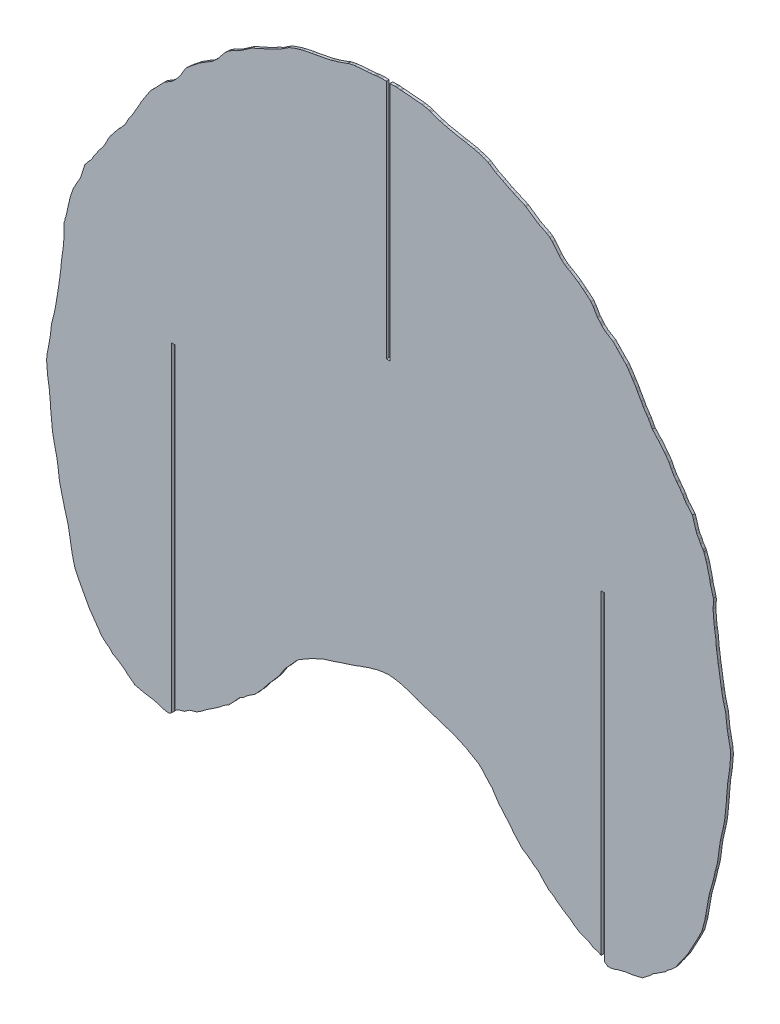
SolidWorks part; units mm, degrees
ref_plane "Спереди" through (0, 0, 0) normal (0, 0, 1) x (1, 0, 0)
ref_plane "Сверху" through (0, 0, 0) normal (0, 1, 0) x (1, 0, 0)
ref_plane "Справа" through (0, 0, 0) normal (1, 0, 0) x (0, 0, -1)
sketch "Model" plane through (0, 0, 0) normal (0, 0, 1) x (1, 0, 0)
  line L0 (-4968.8727, 2054.1459) -> (-4972.0302, 2054.3033)
  line L1 (-4972.0302, 2054.3033) -> (-4973.663, 2054.203)
  line L2 (-4973.663, 2054.203) -> (-4975.2956, 2054.1029)
  line L3 (-4975.2956, 2054.1029) -> (-4975.8599, 2054.0262)
  line L4 (-4975.8599, 2054.0262) -> (-4976.4242, 2053.9498)
  line L5 (-4976.4242, 2053.9498) -> (-4976.672, 2053.8861)
  line L6 (-4976.672, 2053.8861) -> (-4976.9199, 2053.8226)
  line L7 (-4976.9199, 2053.8226) -> (-4978.1276, 2053.6493)
  line L8 (-4978.1276, 2053.6493) -> (-4980.5238, 2053.4764)
  line L9 (-4980.5238, 2053.4764) -> (-4982.9202, 2053.3033)
  line L10 (-4982.9202, 2053.3033) -> (-4991.4543, 2052.597)
  line L11 (-4991.4543, 2052.597) -> (-4992.0593, 2052.4813)
  line L12 (-4992.0593, 2052.4813) -> (-4994.2126, 2052.0589)
  line L13 (-4994.2126, 2052.0589) -> (-4996.3659, 2051.6368)
  line L14 (-4996.3659, 2051.6368) -> (-4996.9471, 2051.3494)
  line L15 (-4996.9471, 2051.3494) -> (-4997.5284, 2051.0623)
  line L16 (-4997.5284, 2051.0623) -> (-5004.2963, 2048.6869)
  line L17 (-5004.2963, 2048.6869) -> (-5005.7665, 2048.3661)
  line L18 (-5005.7665, 2048.3661) -> (-5007.3816, 2047.8578)
  line L19 (-5007.3816, 2047.8578) -> (-5008.9967, 2047.3497)
  line L20 (-5008.9967, 2047.3497) -> (-5020.1828, 2045.1541)
  line L21 (-5020.1828, 2045.1541) -> (-5022.5702, 2044.7743)
  line L22 (-5022.5702, 2044.7743) -> (-5028.8949, 2043.4935)
  line L23 (-5028.8949, 2043.4935) -> (-5030.5226, 2043.0555)
  line L24 (-5030.5226, 2043.0555) -> (-5032.1504, 2042.6173)
  line L25 (-5032.1504, 2042.6173) -> (-5033.9631, 2042.0238)
  line L26 (-5033.9631, 2042.0238) -> (-5035.7756, 2041.4305)
  line L27 (-5035.7756, 2041.4305) -> (-5038.7476, 2040.2767)
  line L28 (-5038.7476, 2040.2767) -> (-5038.9575, 2040.1732)
  line L29 (-5038.9575, 2040.1732) -> (-5039.1675, 2040.0694)
  line L30 (-5039.1675, 2040.0694) -> (-5040.488, 2039.2628)
  line L31 (-5040.488, 2039.2628) -> (-5044.7383, 2036.4613)
  line L32 (-5044.7383, 2036.4613) -> (-5048.6056, 2034.6222)
  line L33 (-5048.6056, 2034.6222) -> (-5055.1681, 2031.0882)
  line L34 (-5055.1681, 2031.0882) -> (-5056.3617, 2030.6375)
  line L35 (-5056.3617, 2030.6375) -> (-5057.5554, 2030.1871)
  line L36 (-5057.5554, 2030.1871) -> (-5065.5879, 2026.5345)
  line L37 (-5065.5879, 2026.5345) -> (-5066.0519, 2026.3006)
  line L38 (-5066.0519, 2026.3006) -> (-5066.6717, 2025.9105)
  line L39 (-5066.6717, 2025.9105) -> (-5074.5742, 2020.4788)
  line L40 (-5074.5742, 2020.4788) -> (-5076.5312, 2019.5111)
  line L41 (-5076.5312, 2019.5111) -> (-5076.5784, 2019.4286)
  line L42 (-5076.5784, 2019.4286) -> (-5076.6257, 2019.3463)
  line L43 (-5076.6257, 2019.3463) -> (-5079.9656, 2017.8443)
  line L44 (-5079.9656, 2017.8443) -> (-5081.328, 2017.0023)
  line L45 (-5081.328, 2017.0023) -> (-5082.6904, 2016.1605)
  line L46 (-5082.6904, 2016.1605) -> (-5084.7595, 2014.4015)
  line L47 (-5084.7595, 2014.4015) -> (-5085.3288, 2013.8426)
  line L48 (-5085.3288, 2013.8426) -> (-5085.8982, 2013.284)
  line L49 (-5085.8982, 2013.284) -> (-5090.5989, 2007.3709)
  line L50 (-5090.5989, 2007.3709) -> (-5091.5746, 2006.5726)
  line L51 (-5091.5746, 2006.5726) -> (-5094.2019, 2004.025)
  line L52 (-5094.2019, 2004.025) -> (-5096.6413, 2002.4683)
  line L53 (-5096.6413, 2002.4683) -> (-5096.8489, 2002.3673)
  line L54 (-5096.8489, 2002.3673) -> (-5097.089, 2002.2513)
  line L55 (-5097.089, 2002.2513) -> (-5097.329, 2002.1351)
  line L56 (-5097.329, 2002.1351) -> (-5097.5746, 2002.035)
  line L57 (-5097.5746, 2002.035) -> (-5104.2345, 1997.7999)
  line L58 (-5104.2345, 1997.7999) -> (-5107.4574, 1995.1798)
  line L59 (-5107.4574, 1995.1798) -> (-5109.2212, 1993.8536)
  line L60 (-5109.2212, 1993.8536) -> (-5113.1637, 1990.419)
  line L61 (-5113.1637, 1990.419) -> (-5114.8129, 1988.1842)
  line L62 (-5114.8129, 1988.1842) -> (-5117.3183, 1983.8524)
  line L63 (-5117.3183, 1983.8524) -> (-5117.5859, 1983.4989)
  line L64 (-5117.5859, 1983.4989) -> (-5117.7652, 1983.1859)
  line L65 (-5117.7652, 1983.1859) -> (-5117.9447, 1982.8726)
  line L66 (-5117.9447, 1982.8726) -> (-5120.415, 1979.971)
  line L67 (-5120.415, 1979.971) -> (-5121.2694, 1978.9647)
  line L68 (-5121.2694, 1978.9647) -> (-5123.8916, 1976.6449)
  line L69 (-5123.8916, 1976.6449) -> (-5125.7547, 1975.5257)
  line L70 (-5125.7547, 1975.5257) -> (-5129.2042, 1973.3988)
  line L71 (-5129.2042, 1973.3988) -> (-5132.4723, 1970.0335)
  line L72 (-5132.4723, 1970.0335) -> (-5135.9791, 1966.3057)
  line L73 (-5135.9791, 1966.3057) -> (-5138.942, 1963.4137)
  line L74 (-5138.942, 1963.4137) -> (-5140.5076, 1961.1207)
  line L75 (-5140.5076, 1961.1207) -> (-5142.9455, 1957.3731)
  line L76 (-5142.9455, 1957.3731) -> (-5145.9204, 1952.7769)
  line L77 (-5145.9204, 1952.7769) -> (-5146.8116, 1950.9649)
  line L78 (-5146.8116, 1950.9649) -> (-5149.9659, 1945.5455)
  line L79 (-5149.9659, 1945.5455) -> (-5151.5932, 1942.5379)
  line L80 (-5151.5932, 1942.5379) -> (-5151.853, 1942.1991)
  line L81 (-5151.853, 1942.1991) -> (-5152.1127, 1941.8599)
  line L82 (-5152.1127, 1941.8599) -> (-5152.943, 1940.5611)
  line L83 (-5152.943, 1940.5611) -> (-5154.7417, 1938.1046)
  line L84 (-5154.7417, 1938.1046) -> (-5157.0868, 1933.6693)
  line L85 (-5157.0868, 1933.6693) -> (-5157.4029, 1933.0824)
  line L86 (-5157.4029, 1933.0824) -> (-5157.7189, 1932.4952)
  line L87 (-5157.7189, 1932.4952) -> (-5158.1402, 1932.0579)
  line L88 (-5158.1402, 1932.0579) -> (-5158.5616, 1931.6209)
  line L89 (-5158.5616, 1931.6209) -> (-5160.8255, 1929.0128)
  line L90 (-5160.8255, 1929.0128) -> (-5162.7114, 1927.212)
  line L91 (-5162.7114, 1927.212) -> (-5165.4336, 1923.7225)
  line L92 (-5165.4336, 1923.7225) -> (-5167.7956, 1920.7745)
  line L93 (-5167.7956, 1920.7745) -> (-5169.6033, 1918.1136)
  line L94 (-5169.6033, 1918.1136) -> (-5171.8115, 1913.5604)
  line L95 (-5171.8115, 1913.5604) -> (-5173.3644, 1911.0863)
  line L96 (-5173.3644, 1911.0863) -> (-5175.1208, 1908.7992)
  line L97 (-5175.1208, 1908.7992) -> (-5175.2746, 1908.6097)
  line L98 (-5175.2746, 1908.6097) -> (-5175.4285, 1908.4205)
  line L99 (-5175.4285, 1908.4205) -> (-5175.6517, 1908.1434)
  line L100 (-5175.6517, 1908.1434) -> (-5175.875, 1907.8661)
  line L101 (-5175.875, 1907.8661) -> (-5176.6948, 1906.6829)
  line L102 (-5176.6948, 1906.6829) -> (-5179.9867, 1902.1703)
  line L103 (-5179.9867, 1902.1703) -> (-5180.2864, 1901.5267)
  line L104 (-5180.2864, 1901.5267) -> (-5180.5861, 1900.8834)
  line L105 (-5180.5861, 1900.8834) -> (-5182.0613, 1898.472)
  line L106 (-5182.0613, 1898.472) -> (-5182.8296, 1897.6698)
  line L107 (-5182.8296, 1897.6698) -> (-5183.598, 1896.8678)
  line L108 (-5183.598, 1896.8678) -> (-5186.4246, 1893.4452)
  line L109 (-5186.4246, 1893.4452) -> (-5187.6987, 1889.7684)
  line L110 (-5187.6987, 1889.7684) -> (-5189.3438, 1884.4974)
  line L111 (-5189.3438, 1884.4974) -> (-5190.1741, 1882.5924)
  line L112 (-5190.1741, 1882.5924) -> (-5191.0915, 1881.0025)
  line L113 (-5191.0915, 1881.0025) -> (-5192.267, 1879.0977)
  line L114 (-5192.267, 1879.0977) -> (-5194.0179, 1875.6866)
  line L115 (-5194.0179, 1875.6866) -> (-5194.181, 1875.4449)
  line L116 (-5194.181, 1875.4449) -> (-5194.3441, 1875.2032)
  line L117 (-5194.3441, 1875.2032) -> (-5195.0731, 1873.9786)
  line L118 (-5195.0731, 1873.9786) -> (-5195.4039, 1872.7362)
  line L119 (-5195.4039, 1872.7362) -> (-5196.543, 1869.6012)
  line L120 (-5196.543, 1869.6012) -> (-5197.0569, 1867.9911)
  line L121 (-5197.0569, 1867.9911) -> (-5198.8898, 1860.2767)
  line L122 (-5198.8898, 1860.2767) -> (-5199.5404, 1856.7767)
  line L123 (-5199.5404, 1856.7767) -> (-5200.4352, 1853.4947)
  line L124 (-5200.4352, 1853.4947) -> (-5200.908, 1852.0909)
  line L125 (-5200.908, 1852.0909) -> (-5200.8514, 1851.8387)
  line L126 (-5200.8514, 1851.8387) -> (-5200.7948, 1851.5865)
  line L127 (-5200.7948, 1851.5865) -> (-5201.6117, 1849.5777)
  line L128 (-5201.6117, 1849.5777) -> (-5201.7248, 1844.9102)
  line L129 (-5201.7248, 1844.9102) -> (-5201.533, 1841.5428)
  line L130 (-5201.533, 1841.5428) -> (-5202.1587, 1833.9964)
  line L131 (-5202.1587, 1833.9964) -> (-5202.4552, 1831.5438)
  line L132 (-5202.4552, 1831.5438) -> (-5202.5878, 1830.888)
  line L133 (-5202.5878, 1830.888) -> (-5203.4105, 1825.2974)
  line L134 (-5203.4105, 1825.2974) -> (-5203.9104, 1819.5023)
  line L135 (-5203.9104, 1819.5023) -> (-5204.0532, 1818.431)
  line L136 (-5204.0532, 1818.431) -> (-5204.1957, 1817.6024)
  line L137 (-5204.1957, 1817.6024) -> (-5204.6232, 1814.0023)
  line L138 (-5204.6232, 1814.0023) -> (-5205.4156, 1808.2989)
  line L139 (-5205.4156, 1808.2989) -> (-5206.5376, 1801.3812)
  line L140 (-5206.5376, 1801.3812) -> (-5207.5008, 1795.5003)
  line L141 (-5207.5008, 1795.5003) -> (-5207.5439, 1795.2913)
  line L142 (-5207.5439, 1795.2913) -> (-5207.587, 1795.0821)
  line L143 (-5207.587, 1795.0821) -> (-5207.6952, 1794.4544)
  line L144 (-5207.6952, 1794.4544) -> (-5207.8033, 1793.8265)
  line L145 (-5207.8033, 1793.8265) -> (-5208.625, 1789.575)
  line L146 (-5208.625, 1789.575) -> (-5209.5233, 1786.1092)
  line L147 (-5209.5233, 1786.1092) -> (-5210.5983, 1781.9095)
  line L148 (-5210.5983, 1781.9095) -> (-5211.0936, 1777.6803)
  line L149 (-5211.0936, 1777.6803) -> (-5211.4256, 1774.3468)
  line L150 (-5211.4256, 1774.3468) -> (-5213.0848, 1764.9271)
  line L151 (-5213.0848, 1764.9271) -> (-5213.9125, 1760.9901)
  line L152 (-5213.9125, 1760.9901) -> (-5214.1803, 1757.7122)
  line L153 (-5214.1803, 1757.7122) -> (-5214.1161, 1755.7657)
  line L154 (-5214.1161, 1755.7657) -> (-5213.505, 1748.0684)
  line L155 (-5213.505, 1748.0684) -> (-5212.2607, 1739.9603)
  line L156 (-5212.2607, 1739.9603) -> (-5211.5113, 1732.1139)
  line L157 (-5211.5113, 1732.1139) -> (-5211.3077, 1729.9154)
  line L158 (-5211.3077, 1729.9154) -> (-5211.2109, 1727.3573)
  line L159 (-5211.2109, 1727.3573) -> (-5210.0478, 1715.6363)
  line L160 (-5210.0478, 1715.6363) -> (-5209.6544, 1712.8114)
  line L161 (-5209.6544, 1712.8114) -> (-5208.789, 1708.6361)
  line L162 (-5208.789, 1708.6361) -> (-5206.7594, 1699.6895)
  line L163 (-5206.7594, 1699.6895) -> (-5206.0224, 1694.8524)
  line L164 (-5206.0224, 1694.8524) -> (-5205.0768, 1687.4057)
  line L165 (-5205.0768, 1687.4057) -> (-5204.6685, 1685.05)
  line L166 (-5204.6685, 1685.05) -> (-5203.6745, 1680.8845)
  line L167 (-5203.6745, 1680.8845) -> (-5202.0981, 1674.6508)
  line L168 (-5202.0981, 1674.6508) -> (-5201.4184, 1671.8281)
  line L169 (-5201.4184, 1671.8281) -> (-5201.3592, 1671.582)
  line L170 (-5201.3592, 1671.582) -> (-5201.3002, 1671.3356)
  line L171 (-5201.3002, 1671.3356) -> (-5198.7179, 1662.2018)
  line L172 (-5198.7179, 1662.2018) -> (-5198.1017, 1658.996)
  line L173 (-5198.1017, 1658.996) -> (-5195.826, 1645.7123)
  line L174 (-5195.826, 1645.7123) -> (-5195.6883, 1644.9848)
  line L175 (-5195.6883, 1644.9848) -> (-5193.5817, 1636.8188)
  line L176 (-5193.5817, 1636.8188) -> (-5190.9919, 1631.5497)
  line L177 (-5190.9919, 1631.5497) -> (-5183.1245, 1616.843)
  line L178 (-5183.1245, 1616.843) -> (-5182.9899, 1616.6684)
  line L179 (-5182.9899, 1616.6684) -> (-5182.8553, 1616.4936)
  line L180 (-5182.8553, 1616.4936) -> (-5182.6518, 1616.2597)
  line L181 (-5182.6518, 1616.2597) -> (-5182.4484, 1616.0256)
  line L182 (-5182.4484, 1616.0256) -> (-5178.5604, 1610.4086)
  line L183 (-5178.5604, 1610.4086) -> (-5178.4538, 1610.3037)
  line L184 (-5178.4538, 1610.3037) -> (-5178.3474, 1610.1987)
  line L185 (-5178.3474, 1610.1987) -> (-5176.9281, 1608.2314)
  line L186 (-5176.9281, 1608.2314) -> (-5175.1366, 1605.4704)
  line L187 (-5175.1366, 1605.4704) -> (-5174.4772, 1604.5788)
  line L188 (-5174.4772, 1604.5788) -> (-5171.3109, 1601.6957)
  line L189 (-5171.3109, 1601.6957) -> (-5168.863, 1599.9902)
  line L190 (-5168.863, 1599.9902) -> (-5166.4711, 1597.381)
  line L191 (-5166.4711, 1597.381) -> (-5162.602, 1595.2116)
  line L192 (-5162.602, 1595.2116) -> (-5157.6942, 1591.8088)
  line L193 (-5157.6942, 1591.8088) -> (-5155.7397, 1589.8405)
  line L194 (-5155.7397, 1589.8405) -> (-5151.4295, 1586.6701)
  line L195 (-5151.4295, 1586.6701) -> (-5150.9988, 1586.2778)
  line L196 (-5150.9988, 1586.2778) -> (-5150.568, 1585.8854)
  line L197 (-5150.568, 1585.8854) -> (-5143.4995, 1584.298)
  line L198 (-5143.4995, 1584.298) -> (-5143.4755, 1584.289)
  line L199 (-5143.4755, 1584.289) -> (-5143.4514, 1584.28)
  line L200 (-5143.4514, 1584.28) -> (-5137.2639, 1583.3273)
  line L201 (-5137.2639, 1583.3273) -> (-5133.1457, 1582.3034)
  line L202 (-5133.1457, 1582.3034) -> (-5132.2015, 1581.9416)
  line L203 (-5132.2015, 1581.9416) -> (-5130.6309, 1581.2924)
  line L204 (-5130.6309, 1581.2924) -> (-5127.2412, 1580.5641)
  line L205 (-5127.2412, 1580.5641) -> (-5126.4065, 1580.5517)
  line L206 (-5126.4065, 1580.5517) -> (-5125.5719, 1580.5392)
  line L207 (-5125.5719, 1580.5392) -> (-5123.8727, 1581.7698)
  line L208 (-5123.8727, 1581.7698) -> (-5123.8727, 1813.0294)
  line L209 (-5123.8727, 1813.0294) -> (-5123.6227, 1813.0294)
  line L210 (-5123.6227, 1813.0294) -> (-5121.6227, 1813.0294)
  line L211 (-5121.6227, 1813.0294) -> (-5121.3727, 1813.0294)
  line L212 (-5121.3727, 1813.0294) -> (-5121.3727, 1584.348)
  line L213 (-5121.3727, 1584.348) -> (-5121.1834, 1584.6359)
  line L214 (-5121.1834, 1584.6359) -> (-5118.9874, 1586.0178)
  line L215 (-5118.9874, 1586.0178) -> (-5115.397, 1587.0524)
  line L216 (-5115.397, 1587.0524) -> (-5115.0943, 1587.0866)
  line L217 (-5115.0943, 1587.0866) -> (-5114.7917, 1587.1208)
  line L218 (-5114.7917, 1587.1208) -> (-5112.686, 1588.6467)
  line L219 (-5112.686, 1588.6467) -> (-5110.8166, 1589.86)
  line L220 (-5110.8166, 1589.86) -> (-5108.547, 1590.4841)
  line L221 (-5108.547, 1590.4841) -> (-5105.4685, 1591.4592)
  line L222 (-5105.4685, 1591.4592) -> (-5105.1032, 1591.7524)
  line L223 (-5105.1032, 1591.7524) -> (-5102.3669, 1593.5261)
  line L224 (-5102.3669, 1593.5261) -> (-5102.0419, 1593.7155)
  line L225 (-5102.0419, 1593.7155) -> (-5101.6626, 1593.9968)
  line L226 (-5101.6626, 1593.9968) -> (-5098.3189, 1596.5908)
  line L227 (-5098.3189, 1596.5908) -> (-5097.6964, 1596.9902)
  line L228 (-5097.6964, 1596.9902) -> (-5093.5776, 1599.644)
  line L229 (-5093.5776, 1599.644) -> (-5089.3653, 1602.5641)
  line L230 (-5089.3653, 1602.5641) -> (-5089.0498, 1602.7995)
  line L231 (-5089.0498, 1602.7995) -> (-5088.7342, 1603.0349)
  line L232 (-5088.7342, 1603.0349) -> (-5088.503, 1603.2453)
  line L233 (-5088.503, 1603.2453) -> (-5086.4233, 1605.0944)
  line L234 (-5086.4233, 1605.0944) -> (-5083.0885, 1607.0036)
  line L235 (-5083.0885, 1607.0036) -> (-5082.894, 1607.1479)
  line L236 (-5082.894, 1607.1479) -> (-5082.6996, 1607.2922)
  line L237 (-5082.6996, 1607.2922) -> (-5081.2502, 1608.8813)
  line L238 (-5081.2502, 1608.8813) -> (-5081.0078, 1609.0805)
  line L239 (-5081.0078, 1609.0805) -> (-5080.7653, 1609.2795)
  line L240 (-5080.7653, 1609.2795) -> (-5077.3286, 1612.9387)
  line L241 (-5077.3286, 1612.9387) -> (-5074.8917, 1615.6755)
  line L242 (-5074.8917, 1615.6755) -> (-5072.2847, 1617.0637)
  line L243 (-5072.2847, 1617.0637) -> (-5071.507, 1617.7709)
  line L244 (-5071.507, 1617.7709) -> (-5070.7293, 1618.4785)
  line L245 (-5070.7293, 1618.4785) -> (-5067.859, 1620.7062)
  line L246 (-5067.859, 1620.7062) -> (-5064.6759, 1622.7372)
  line L247 (-5064.6759, 1622.7372) -> (-5063.9843, 1623.165)
  line L248 (-5063.9843, 1623.165) -> (-5063.8931, 1623.2812)
  line L249 (-5063.8931, 1623.2812) -> (-5063.8019, 1623.3972)
  line L250 (-5063.8019, 1623.3972) -> (-5062.3375, 1624.8068)
  line L251 (-5062.3375, 1624.8068) -> (-5061.8405, 1625.3657)
  line L252 (-5061.8405, 1625.3657) -> (-5061.3435, 1625.9247)
  line L253 (-5061.3435, 1625.9247) -> (-5060.8541, 1626.581)
  line L254 (-5060.8541, 1626.581) -> (-5059.1918, 1628.329)
  line L255 (-5059.1918, 1628.329) -> (-5057.9394, 1629.7172)
  line L256 (-5057.9394, 1629.7172) -> (-5053.7328, 1635.1613)
  line L257 (-5053.7328, 1635.1613) -> (-5050.181, 1639.0624)
  line L258 (-5050.181, 1639.0624) -> (-5048.9465, 1640.624)
  line L259 (-5048.9465, 1640.624) -> (-5046.6965, 1643.2211)
  line L260 (-5046.6965, 1643.2211) -> (-5046.0735, 1644.1039)
  line L261 (-5046.0735, 1644.1039) -> (-5045.8248, 1644.4638)
  line L262 (-5045.8248, 1644.4638) -> (-5045.5761, 1644.8239)
  line L263 (-5045.5761, 1644.8239) -> (-5042.0526, 1650.3654)
  line L264 (-5042.0526, 1650.3654) -> (-5039.5996, 1652.8549)
  line L265 (-5039.5996, 1652.8549) -> (-5035.806, 1657.1555)
  line L266 (-5035.806, 1657.1555) -> (-5035.4493, 1657.5766)
  line L267 (-5035.4493, 1657.5766) -> (-5035.0926, 1657.9975)
  line L268 (-5035.0926, 1657.9975) -> (-5034.7793, 1658.3046)
  line L269 (-5034.7793, 1658.3046) -> (-5032.3949, 1660.6042)
  line L270 (-5032.3949, 1660.6042) -> (-5031.7991, 1661.0515)
  line L271 (-5031.7991, 1661.0515) -> (-5028.3648, 1663.0141)
  line L272 (-5028.3648, 1663.0141) -> (-5027.626, 1663.373)
  line L273 (-5027.626, 1663.373) -> (-5026.8873, 1663.7316)
  line L274 (-5026.8873, 1663.7316) -> (-5022.8968, 1666.3168)
  line L275 (-5022.8968, 1666.3168) -> (-5020.8633, 1667.0917)
  line L276 (-5020.8633, 1667.0917) -> (-5016.7375, 1668.9431)
  line L277 (-5016.7375, 1668.9431) -> (-5014.5204, 1669.9709)
  line L278 (-5014.5204, 1669.9709) -> (-5012.2576, 1670.7331)
  line L279 (-5012.2576, 1670.7331) -> (-5006.7235, 1672.4228)
  line L280 (-5006.7235, 1672.4228) -> (-5004.0275, 1673.3671)
  line L281 (-5004.0275, 1673.3671) -> (-5001.0419, 1674.3935)
  line L282 (-5001.0419, 1674.3935) -> (-4999.816, 1674.7631)
  line L283 (-4999.816, 1674.7631) -> (-4993.3539, 1676.8312)
  line L284 (-4993.3539, 1676.8312) -> (-4991.7895, 1677.3876)
  line L285 (-4991.7895, 1677.3876) -> (-4990.225, 1677.9438)
  line L286 (-4990.225, 1677.9438) -> (-4988.3602, 1678.7006)
  line L287 (-4988.3602, 1678.7006) -> (-4982.4717, 1680.756)
  line L288 (-4982.4717, 1680.756) -> (-4981.0961, 1681.2219)
  line L289 (-4981.0961, 1681.2219) -> (-4979.1022, 1681.737)
  line L290 (-4979.1022, 1681.737) -> (-4977.3762, 1682.2397)
  line L291 (-4977.3762, 1682.2397) -> (-4975.6503, 1682.7421)
  line L292 (-4975.6503, 1682.7421) -> (-4972.0091, 1683.4379)
  line L293 (-4972.0091, 1683.4379) -> (-4971.2378, 1683.5224)
  line L294 (-4971.2378, 1683.5224) -> (-4969.2404, 1683.7172)
  line L295 (-4969.2404, 1683.7172) -> (-4967.243, 1683.9123)
  line L296 (-4967.243, 1683.9123) -> (-4962.9819, 1683.4909)
  line L297 (-4962.9819, 1683.4909) -> (-4962.7442, 1683.4636)
  line L298 (-4962.7442, 1683.4636) -> (-4958.3861, 1682.6037)
  line L299 (-4958.3861, 1682.6037) -> (-4957.2288, 1682.267)
  line L300 (-4957.2288, 1682.267) -> (-4956.0715, 1681.9301)
  line L301 (-4956.0715, 1681.9301) -> (-4953.4155, 1681.2255)
  line L302 (-4953.4155, 1681.2255) -> (-4952.8118, 1681.0224)
  line L303 (-4952.8118, 1681.0224) -> (-4952.2082, 1680.8195)
  line L304 (-4952.2082, 1680.8195) -> (-4946.452, 1678.8227)
  line L305 (-4946.452, 1678.8227) -> (-4944.5178, 1678.0297)
  line L306 (-4944.5178, 1678.0297) -> (-4942.9518, 1677.4697)
  line L307 (-4942.9518, 1677.4697) -> (-4941.3857, 1676.9099)
  line L308 (-4941.3857, 1676.9099) -> (-4935.0289, 1674.8754)
  line L309 (-4935.0289, 1674.8754) -> (-4934.1433, 1674.6044)
  line L310 (-4934.1433, 1674.6044) -> (-4933.2578, 1674.3332)
  line L311 (-4933.2578, 1674.3332) -> (-4930.4501, 1673.364)
  line L312 (-4930.4501, 1673.364) -> (-4927.8411, 1672.4499)
  line L313 (-4927.8411, 1672.4499) -> (-4922.2894, 1670.7546)
  line L314 (-4922.2894, 1670.7546) -> (-4920.0846, 1670.0207)
  line L315 (-4920.0846, 1670.0207) -> (-4917.8295, 1668.9743)
  line L316 (-4917.8295, 1668.9743) -> (-4913.6374, 1667.1061)
  line L317 (-4913.6374, 1667.1061) -> (-4912.6311, 1666.7206)
  line L318 (-4912.6311, 1666.7206) -> (-4911.6247, 1666.3349)
  line L319 (-4911.6247, 1666.3349) -> (-4907.9579, 1663.9555)
  line L320 (-4907.9579, 1663.9555) -> (-4906.3558, 1663.1762)
  line L321 (-4906.3558, 1663.1762) -> (-4902.4795, 1660.8893)
  line L322 (-4902.4795, 1660.8893) -> (-4901.9717, 1660.506)
  line L323 (-4901.9717, 1660.506) -> (-4901.4401, 1659.9819)
  line L324 (-4901.4401, 1659.9819) -> (-4900.9086, 1659.4575)
  line L325 (-4900.9086, 1659.4575) -> (-4899.8085, 1658.3959)
  line L326 (-4899.8085, 1658.3959) -> (-4899.5545, 1658.1777)
  line L327 (-4899.5545, 1658.1777) -> (-4899.3005, 1657.9597)
  line L328 (-4899.3005, 1657.9597) -> (-4898.7216, 1657.267)
  line L329 (-4898.7216, 1657.267) -> (-4898.1427, 1656.5742)
  line L330 (-4898.1427, 1656.5742) -> (-4894.8082, 1652.7819)
  line L331 (-4894.8082, 1652.7819) -> (-4892.5626, 1650.518)
  line L332 (-4892.5626, 1650.518) -> (-4888.7395, 1644.5732)
  line L333 (-4888.7395, 1644.5732) -> (-4888.2632, 1643.8832)
  line L334 (-4888.2632, 1643.8832) -> (-4887.7915, 1643.2187)
  line L335 (-4887.7915, 1643.2187) -> (-4885.517, 1640.5974)
  line L336 (-4885.517, 1640.5974) -> (-4884.9884, 1639.9155)
  line L337 (-4884.9884, 1639.9155) -> (-4884.4598, 1639.2333)
  line L338 (-4884.4598, 1639.2333) -> (-4880.9065, 1635.3488)
  line L339 (-4880.9065, 1635.3488) -> (-4876.6459, 1629.8408)
  line L340 (-4876.6459, 1629.8408) -> (-4875.9082, 1629.0092)
  line L341 (-4875.9082, 1629.0092) -> (-4875.1705, 1628.1779)
  line L342 (-4875.1705, 1628.1779) -> (-4874.3877, 1627.3574)
  line L343 (-4874.3877, 1627.3574) -> (-4873.605, 1626.5366)
  line L344 (-4873.605, 1626.5366) -> (-4873.3925, 1626.2504)
  line L345 (-4873.3925, 1626.2504) -> (-4873.18, 1625.9645)
  line L346 (-4873.18, 1625.9645) -> (-4872.4815, 1625.1782)
  line L347 (-4872.4815, 1625.1782) -> (-4871.7829, 1624.392)
  line L348 (-4871.7829, 1624.392) -> (-4871.1856, 1623.7978)
  line L349 (-4871.1856, 1623.7978) -> (-4870.5884, 1623.2038)
  line L350 (-4870.5884, 1623.2038) -> (-4867.0462, 1621.0175)
  line L351 (-4867.0462, 1621.0175) -> (-4863.9005, 1618.6157)
  line L352 (-4863.9005, 1618.6157) -> (-4862.0782, 1616.9848)
  line L353 (-4862.0782, 1616.9848) -> (-4859.4594, 1615.5244)
  line L354 (-4859.4594, 1615.5244) -> (-4857.1997, 1612.9977)
  line L355 (-4857.1997, 1612.9977) -> (-4853.9066, 1609.4887)
  line L356 (-4853.9066, 1609.4887) -> (-4853.6626, 1609.2939)
  line L357 (-4853.6626, 1609.2939) -> (-4853.4186, 1609.0993)
  line L358 (-4853.4186, 1609.0993) -> (-4851.745, 1607.2741)
  line L359 (-4851.745, 1607.2741) -> (-4851.4789, 1607.08)
  line L360 (-4851.4789, 1607.08) -> (-4848.0784, 1605.093)
  line L361 (-4848.0784, 1605.093) -> (-4845.9331, 1603.1901)
  line L362 (-4845.9331, 1603.1901) -> (-4845.7706, 1603.0441)
  line L363 (-4845.7706, 1603.0441) -> (-4845.5417, 1602.8725)
  line L364 (-4845.5417, 1602.8725) -> (-4845.3129, 1602.7009)
  line L365 (-4845.3129, 1602.7009) -> (-4840.9825, 1599.696)
  line L366 (-4840.9825, 1599.696) -> (-4836.569, 1596.8412)
  line L367 (-4836.569, 1596.8412) -> (-4835.8977, 1596.4091)
  line L368 (-4835.8977, 1596.4091) -> (-4832.5417, 1593.7834)
  line L369 (-4832.5417, 1593.7834) -> (-4832.3936, 1593.673)
  line L370 (-4832.3936, 1593.673) -> (-4832.1944, 1593.5554)
  line L371 (-4832.1944, 1593.5554) -> (-4829.1652, 1591.6486)
  line L372 (-4829.1652, 1591.6486) -> (-4829.0364, 1591.5475)
  line L373 (-4829.0364, 1591.5475) -> (-4828.9076, 1591.4462)
  line L374 (-4828.9076, 1591.4462) -> (-4824.8551, 1590.0954)
  line L375 (-4824.8551, 1590.0954) -> (-4824.0622, 1589.8549)
  line L376 (-4824.0622, 1589.8549) -> (-4823.2694, 1589.6147)
  line L377 (-4823.2694, 1589.6147) -> (-4821.3925, 1588.4377)
  line L378 (-4821.3925, 1588.4377) -> (-4819.3338, 1587.0773)
  line L379 (-4819.3338, 1587.0773) -> (-4819.0783, 1587.0436)
  line L380 (-4819.0783, 1587.0436) -> (-4815.5281, 1586.0871)
  line L381 (-4815.5281, 1586.0871) -> (-4813.8727, 1585.0164)
  line L382 (-4813.8727, 1585.0164) -> (-4813.8727, 1813.0294)
  line L383 (-4813.8727, 1813.0294) -> (-4813.6227, 1813.0294)
  line L384 (-4813.6227, 1813.0294) -> (-4811.6227, 1813.0294)
  line L385 (-4811.6227, 1813.0294) -> (-4811.3727, 1813.0294)
  line L386 (-4811.3727, 1813.0294) -> (-4811.3727, 1582.3366)
  line L387 (-4811.3727, 1582.3366) -> (-4808.9881, 1580.6149)
  line L388 (-4808.9881, 1580.6149) -> (-4808.079, 1580.6064)
  line L389 (-4808.079, 1580.6064) -> (-4807.17, 1580.5978)
  line L390 (-4807.17, 1580.5978) -> (-4803.6589, 1581.3325)
  line L391 (-4803.6589, 1581.3325) -> (-4801.8012, 1582.1266)
  line L392 (-4801.8012, 1582.1266) -> (-4797.4124, 1583.2358)
  line L393 (-4797.4124, 1583.2358) -> (-4796.3289, 1583.5266)
  line L394 (-4796.3289, 1583.5266) -> (-4791.6233, 1584.1271)
  line L395 (-4791.6233, 1584.1271) -> (-4791.5244, 1584.1252)
  line L396 (-4791.5244, 1584.1252) -> (-4791.384, 1584.165)
  line L397 (-4791.384, 1584.165) -> (-4783.7893, 1585.9287)
  line L398 (-4783.7893, 1585.9287) -> (-4782.5276, 1587.0746)
  line L399 (-4782.5276, 1587.0746) -> (-4778.4067, 1590.1418)
  line L400 (-4778.4067, 1590.1418) -> (-4776.3628, 1592.361)
  line L401 (-4776.3628, 1592.361) -> (-4774.858, 1593.1547)
  line L402 (-4774.858, 1593.1547) -> (-4769.1078, 1596.9411)
  line L403 (-4769.1078, 1596.9411) -> (-4768.3944, 1597.363)
  line L404 (-4768.3944, 1597.363) -> (-4767.681, 1597.7849)
  line L405 (-4767.681, 1597.7849) -> (-4765.6437, 1599.9318)
  line L406 (-4765.6437, 1599.9318) -> (-4762.9992, 1601.8095)
  line L407 (-4762.9992, 1601.8095) -> (-4760.045, 1604.5556)
  line L408 (-4760.045, 1604.5556) -> (-4759.3583, 1605.4672)
  line L409 (-4759.3583, 1605.4672) -> (-4757.7624, 1607.9523)
  line L410 (-4757.7624, 1607.9523) -> (-4756.1808, 1610.135)
  line L411 (-4756.1808, 1610.135) -> (-4756.0369, 1610.2807)
  line L412 (-4756.0369, 1610.2807) -> (-4755.8929, 1610.4267)
  line L413 (-4755.8929, 1610.4267) -> (-4751.9327, 1616.1684)
  line L414 (-4751.9327, 1616.1684) -> (-4751.7775, 1616.3461)
  line L415 (-4751.7775, 1616.3461) -> (-4751.6223, 1616.5241)
  line L416 (-4751.6223, 1616.5241) -> (-4751.3947, 1616.821)
  line L417 (-4751.3947, 1616.821) -> (-4743.6651, 1631.1818)
  line L418 (-4743.6651, 1631.1818) -> (-4740.9346, 1636.787)
  line L419 (-4740.9346, 1636.787) -> (-4738.7562, 1645.2329)
  line L420 (-4738.7562, 1645.2329) -> (-4738.5736, 1646.4089)
  line L421 (-4738.5736, 1646.4089) -> (-4738.4927, 1646.7685)
  line L422 (-4738.4927, 1646.7685) -> (-4738.4118, 1647.1279)
  line L423 (-4738.4118, 1647.1279) -> (-4736.2121, 1659.831)
  line L424 (-4736.2121, 1659.831) -> (-4735.7923, 1662.0156)
  line L425 (-4735.7923, 1662.0156) -> (-4733.0704, 1671.6523)
  line L426 (-4733.0704, 1671.6523) -> (-4732.9847, 1672.0082)
  line L427 (-4732.9847, 1672.0082) -> (-4732.0597, 1675.8981)
  line L428 (-4732.0597, 1675.8981) -> (-4731.4685, 1678.665)
  line L429 (-4731.4685, 1678.665) -> (-4731.0293, 1680.0522)
  line L430 (-4731.0293, 1680.0522) -> (-4729.8158, 1685.0424)
  line L431 (-4729.8158, 1685.0424) -> (-4729.4368, 1687.2199)
  line L432 (-4729.4368, 1687.2199) -> (-4728.4796, 1694.773)
  line L433 (-4728.4796, 1694.773) -> (-4727.7531, 1699.5606)
  line L434 (-4727.7531, 1699.5606) -> (-4725.7171, 1708.4937)
  line L435 (-4725.7171, 1708.4937) -> (-4724.7385, 1713.3101)
  line L436 (-4724.7385, 1713.3101) -> (-4724.4131, 1715.7723)
  line L437 (-4724.4131, 1715.7723) -> (-4723.2833, 1727.2525)
  line L438 (-4723.2833, 1727.2525) -> (-4723.2245, 1729.0404)
  line L439 (-4723.2245, 1729.0404) -> (-4723.0715, 1730.8309)
  line L440 (-4723.0715, 1730.8309) -> (-4722.3237, 1739.1668)
  line L441 (-4722.3237, 1739.1668) -> (-4721.0403, 1747.5277)
  line L442 (-4721.0403, 1747.5277) -> (-4720.3841, 1755.2203)
  line L443 (-4720.3841, 1755.2203) -> (-4720.3108, 1757.1593)
  line L444 (-4720.3108, 1757.1593) -> (-4720.5553, 1760.9503)
  line L445 (-4720.5553, 1760.9503) -> (-4721.8178, 1767.3455)
  line L446 (-4721.8178, 1767.3455) -> (-4722.7309, 1771.8958)
  line L447 (-4722.7309, 1771.8958) -> (-4723.3947, 1777.4344)
  line L448 (-4723.3947, 1777.4344) -> (-4723.8632, 1781.9972)
  line L449 (-4723.8632, 1781.9972) -> (-4725.0907, 1786.5301)
  line L450 (-4725.0907, 1786.5301) -> (-4725.8098, 1789.3065)
  line L451 (-4725.8098, 1789.3065) -> (-4726.7435, 1794.2271)
  line L452 (-4726.7435, 1794.2271) -> (-4726.8844, 1795.0738)
  line L453 (-4726.8844, 1795.0738) -> (-4726.929, 1795.2801)
  line L454 (-4726.929, 1795.2801) -> (-4726.9737, 1795.4862)
  line L455 (-4726.9737, 1795.4862) -> (-4728.8599, 1807.5277)
  line L456 (-4728.8599, 1807.5277) -> (-4729.2599, 1809.6065)
  line L457 (-4729.2599, 1809.6065) -> (-4729.5174, 1811.6219)
  line L458 (-4729.5174, 1811.6219) -> (-4730.2805, 1817.1783)
  line L459 (-4730.2805, 1817.1783) -> (-4730.4728, 1818.2848)
  line L460 (-4730.4728, 1818.2848) -> (-4730.6829, 1819.9058)
  line L461 (-4730.6829, 1819.9058) -> (-4731.0396, 1825.1287)
  line L462 (-4731.0396, 1825.1287) -> (-4731.7879, 1830.0106)
  line L463 (-4731.7879, 1830.0106) -> (-4731.8681, 1830.4036)
  line L464 (-4731.8681, 1830.4036) -> (-4731.9482, 1830.7965)
  line L465 (-4731.9482, 1830.7965) -> (-4732.3087, 1833.7484)
  line L466 (-4732.3087, 1833.7484) -> (-4732.9734, 1842.1131)
  line L467 (-4732.9734, 1842.1131) -> (-4732.6384, 1846.3836)
  line L468 (-4732.6384, 1846.3836) -> (-4732.6753, 1848.9591)
  line L469 (-4732.6753, 1848.9591) -> (-4733.1838, 1850.4398)
  line L470 (-4733.1838, 1850.4398) -> (-4734.9946, 1857.1217)
  line L471 (-4734.9946, 1857.1217) -> (-4735.1671, 1858.1517)
  line L472 (-4735.1671, 1858.1517) -> (-4735.3003, 1859.1905)
  line L473 (-4735.3003, 1859.1905) -> (-4737.541, 1868.3878)
  line L474 (-4737.541, 1868.3878) -> (-4738.1353, 1870.2623)
  line L475 (-4738.1353, 1870.2623) -> (-4739.3508, 1873.6265)
  line L476 (-4739.3508, 1873.6265) -> (-4739.6189, 1874.5479)
  line L477 (-4739.6189, 1874.5479) -> (-4740.0347, 1875.2296)
  line L478 (-4740.0347, 1875.2296) -> (-4740.2577, 1875.5999)
  line L479 (-4740.2577, 1875.5999) -> (-4740.4808, 1875.9701)
  line L480 (-4740.4808, 1875.9701) -> (-4741.9681, 1878.056)
  line L481 (-4741.9681, 1878.056) -> (-4743.1249, 1880.6058)
  line L482 (-4743.1249, 1880.6058) -> (-4744.5983, 1883.1046)
  line L483 (-4744.5983, 1883.1046) -> (-4745.2744, 1884.8814)
  line L484 (-4745.2744, 1884.8814) -> (-4747.1001, 1890.9259)
  line L485 (-4747.1001, 1890.9259) -> (-4747.8925, 1893.3028)
  line L486 (-4747.8925, 1893.3028) -> (-4751.2438, 1897.2765)
  line L487 (-4751.2438, 1897.2765) -> (-4751.7889, 1897.8319)
  line L488 (-4751.7889, 1897.8319) -> (-4752.334, 1898.3875)
  line L489 (-4752.334, 1898.3875) -> (-4753.0079, 1899.391)
  line L490 (-4753.0079, 1899.391) -> (-4753.6818, 1900.3946)
  line L491 (-4753.6818, 1900.3946) -> (-4754.8793, 1902.7498)
  line L492 (-4754.8793, 1902.7498) -> (-4757.1518, 1905.8548)
  line L493 (-4757.1518, 1905.8548) -> (-4758.7462, 1908.0252)
  line L494 (-4758.7462, 1908.0252) -> (-4759.0534, 1908.3895)
  line L495 (-4759.0534, 1908.3895) -> (-4759.3606, 1908.754)
  line L496 (-4759.3606, 1908.754) -> (-4761.2803, 1911.3307)
  line L497 (-4761.2803, 1911.3307) -> (-4763.0659, 1914.4796)
  line L498 (-4763.0659, 1914.4796) -> (-4764.7316, 1917.9366)
  line L499 (-4764.7316, 1917.9366) -> (-4766.951, 1921.1024)
  line L500 (-4766.951, 1921.1024) -> (-4767.5013, 1921.7889)
  line L501 (-4767.5013, 1921.7889) -> (-4768.0516, 1922.4752)
  line L502 (-4768.0516, 1922.4752) -> (-4771.9487, 1927.4098)
  line L503 (-4771.9487, 1927.4098) -> (-4772.772, 1928.1888)
  line L504 (-4772.772, 1928.1888) -> (-4773.5953, 1928.9681)
  line L505 (-4773.5953, 1928.9681) -> (-4775.9155, 1931.6517)
  line L506 (-4775.9155, 1931.6517) -> (-4776.7616, 1932.5116)
  line L507 (-4776.7616, 1932.5116) -> (-4777.5003, 1933.8724)
  line L508 (-4777.5003, 1933.8724) -> (-4779.6097, 1937.8289)
  line L509 (-4779.6097, 1937.8289) -> (-4780.739, 1939.4163)
  line L510 (-4780.739, 1939.4163) -> (-4783.2468, 1943.1312)
  line L511 (-4783.2468, 1943.1312) -> (-4784.7888, 1945.9925)
  line L512 (-4784.7888, 1945.9925) -> (-4787.5125, 1950.6598)
  line L513 (-4787.5125, 1950.6598) -> (-4788.4831, 1952.609)
  line L514 (-4788.4831, 1952.609) -> (-4790.4585, 1955.6905)
  line L515 (-4790.4585, 1955.6905) -> (-4790.9613, 1956.4925)
  line L516 (-4790.9613, 1956.4925) -> (-4791.4641, 1957.2948)
  line L517 (-4791.4641, 1957.2948) -> (-4794.0087, 1961.1864)
  line L518 (-4794.0087, 1961.1864) -> (-4795.6412, 1963.5531)
  line L519 (-4795.6412, 1963.5531) -> (-4798.447, 1966.2743)
  line L520 (-4798.447, 1966.2743) -> (-4802.0708, 1970.0855)
  line L521 (-4802.0708, 1970.0855) -> (-4805.2643, 1973.3773)
  line L522 (-4805.2643, 1973.3773) -> (-4808.5898, 1975.4132)
  line L523 (-4808.5898, 1975.4132) -> (-4809.5959, 1976.0247)
  line L524 (-4809.5959, 1976.0247) -> (-4810.602, 1976.6361)
  line L525 (-4810.602, 1976.6361) -> (-4813.3088, 1979.0133)
  line L526 (-4813.3088, 1979.0133) -> (-4813.9673, 1979.8529)
  line L527 (-4813.9673, 1979.8529) -> (-4814.6258, 1980.6922)
  line L528 (-4814.6258, 1980.6922) -> (-4816.1781, 1982.4412)
  line L529 (-4816.1781, 1982.4412) -> (-4816.2238, 1982.4964)
  line L530 (-4816.2238, 1982.4964) -> (-4816.2694, 1982.5514)
  line L531 (-4816.2694, 1982.5514) -> (-4816.3193, 1982.6034)
  line L532 (-4816.3193, 1982.6034) -> (-4816.3693, 1982.6556)
  line L533 (-4816.3693, 1982.6556) -> (-4816.4719, 1982.783)
  line L534 (-4816.4719, 1982.783) -> (-4819.5277, 1987.9828)
  line L535 (-4819.5277, 1987.9828) -> (-4821.1998, 1990.3106)
  line L536 (-4821.1998, 1990.3106) -> (-4825.3565, 1993.9305)
  line L537 (-4825.3565, 1993.9305) -> (-4826.2054, 1994.5667)
  line L538 (-4826.2054, 1994.5667) -> (-4827.0543, 1995.2032)
  line L539 (-4827.0543, 1995.2032) -> (-4830.1744, 1997.7264)
  line L540 (-4830.1744, 1997.7264) -> (-4836.4026, 2001.7577)
  line L541 (-4836.4026, 2001.7577) -> (-4837.6654, 2002.3231)
  line L542 (-4837.6654, 2002.3231) -> (-4837.7605, 2002.3631)
  line L543 (-4837.7605, 2002.3631) -> (-4837.8555, 2002.4034)
  line L544 (-4837.8555, 2002.4034) -> (-4838.934, 2003.1493)
  line L545 (-4838.934, 2003.1493) -> (-4840.0126, 2003.8953)
  line L546 (-4840.0126, 2003.8953) -> (-4842.0925, 2005.5072)
  line L547 (-4842.0925, 2005.5072) -> (-4844.1068, 2007.6297)
  line L548 (-4844.1068, 2007.6297) -> (-4848.9925, 2013.7328)
  line L549 (-4848.9925, 2013.7328) -> (-4850.8233, 2015.5199)
  line L550 (-4850.8233, 2015.5199) -> (-4853.006, 2016.9505)
  line L551 (-4853.006, 2016.9505) -> (-4859.4101, 2020.1143)
  line L552 (-4859.4101, 2020.1143) -> (-4868.0518, 2026.0907)
  line L553 (-4868.0518, 2026.0907) -> (-4868.3696, 2026.2923)
  line L554 (-4868.3696, 2026.2923) -> (-4868.5596, 2026.3939)
  line L555 (-4868.5596, 2026.3939) -> (-4868.7496, 2026.4957)
  line L556 (-4868.7496, 2026.4957) -> (-4876.5772, 2029.9972)
  line L557 (-4876.5772, 2029.9972) -> (-4879.8903, 2031.3687)
  line L558 (-4879.8903, 2031.3687) -> (-4884.7735, 2034.0235)
  line L559 (-4884.7735, 2034.0235) -> (-4890.014, 2036.5992)
  line L560 (-4890.014, 2036.5992) -> (-4894.0471, 2039.2953)
  line L561 (-4894.0471, 2039.2953) -> (-4895.3162, 2040.0706)
  line L562 (-4895.3162, 2040.0706) -> (-4895.7127, 2040.2664)
  line L563 (-4895.7127, 2040.2664) -> (-4898.6185, 2041.3949)
  line L564 (-4898.6185, 2041.3949) -> (-4900.4885, 2042.0135)
  line L565 (-4900.4885, 2042.0135) -> (-4902.3585, 2042.6324)
  line L566 (-4902.3585, 2042.6324) -> (-4903.9816, 2043.0716)
  line L567 (-4903.9816, 2043.0716) -> (-4905.6046, 2043.5111)
  line L568 (-4905.6046, 2043.5111) -> (-4911.6309, 2044.7108)
  line L569 (-4911.6309, 2044.7108) -> (-4913.0628, 2044.9388)
  line L570 (-4913.0628, 2044.9388) -> (-4914.4947, 2045.1666)
  line L571 (-4914.4947, 2045.1666) -> (-4925.4549, 2047.3392)
  line L572 (-4925.4549, 2047.3392) -> (-4928.6656, 2048.3436)
  line L573 (-4928.6656, 2048.3436) -> (-4930.0995, 2048.6561)
  line L574 (-4930.0995, 2048.6561) -> (-4936.5582, 2050.9171)
  line L575 (-4936.5582, 2050.9171) -> (-4937.2486, 2051.2523)
  line L576 (-4937.2486, 2051.2523) -> (-4937.9391, 2051.5877)
  line L577 (-4937.9391, 2051.5877) -> (-4940.2086, 2052.0272)
  line L578 (-4940.2086, 2052.0272) -> (-4942.4781, 2052.4664)
  line L579 (-4942.4781, 2052.4664) -> (-4943.2266, 2052.5973)
  line L580 (-4943.2266, 2052.5973) -> (-4957.8572, 2053.8648)
  line L581 (-4957.8572, 2053.8648) -> (-4958.454, 2053.8741)
  line L582 (-4958.454, 2053.8741) -> (-4959.0399, 2053.8614)
  line L583 (-4959.0399, 2053.8614) -> (-4961.0199, 2054.2266)
  line L584 (-4961.0199, 2054.2266) -> (-4961.8385, 2054.1825)
  line L585 (-4961.8385, 2054.1825) -> (-4962.6571, 2054.1385)
  line L586 (-4962.6571, 2054.1385) -> (-4966.3727, 2054.0785)
  line L587 (-4966.3727, 2054.0785) -> (-4966.3727, 1880.5521)
  line L588 (-4966.3727, 1880.5521) -> (-4966.6227, 1880.5521)
  line L589 (-4966.6227, 1880.5521) -> (-4968.6227, 1880.5521)
  line L590 (-4968.6227, 1880.5521) -> (-4968.8727, 1880.5521)
  line L591 (-4968.8727, 1880.5521) -> (-4968.8727, 2054.1459)
extrude "Бобышка-Вытянуть1" add sketch "Model" along normal blind 2
